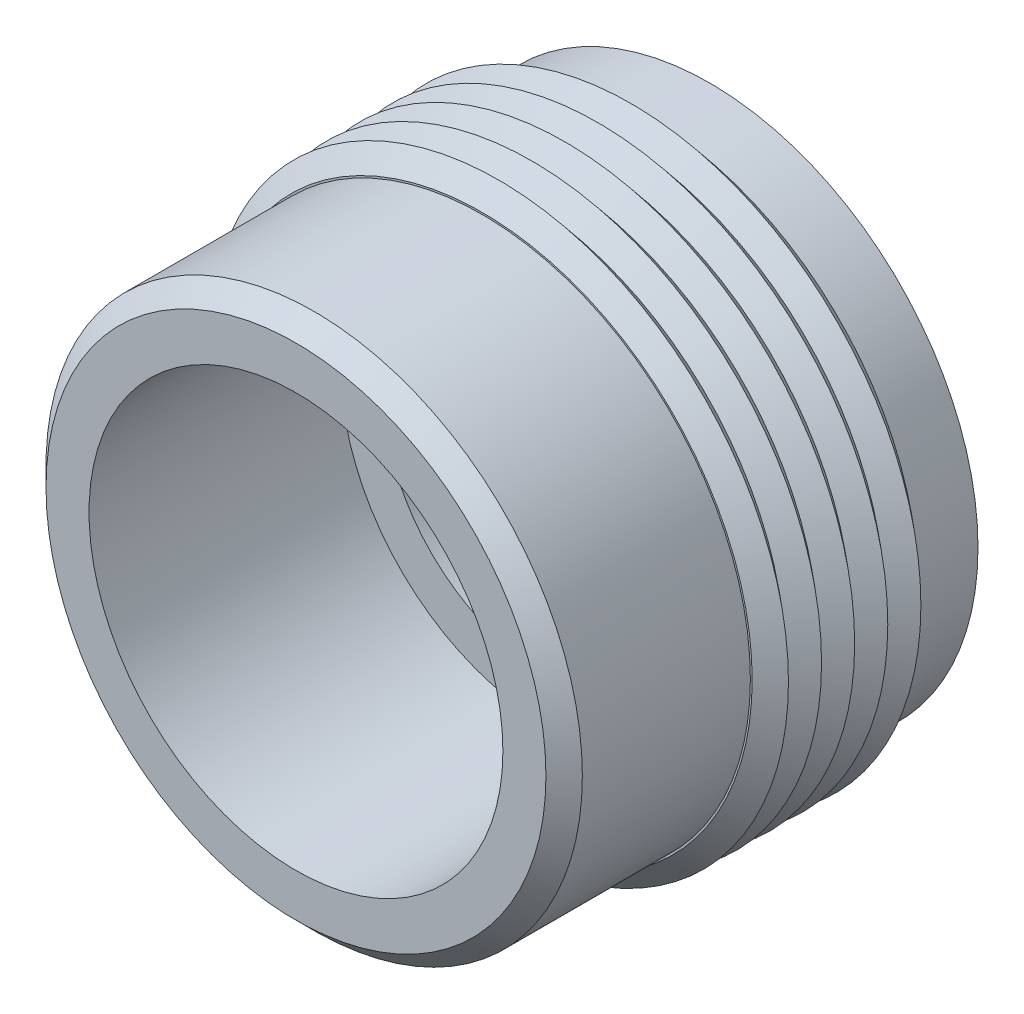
SolidWorks part; units mm, degrees
ref_plane "Front" through (0, 0, 0) normal (0, 0, 1) x (1, 0, 0)
ref_plane "Top" through (0, 0, 0) normal (0, 1, 0) x (1, 0, 0)
ref_plane "Right" through (0, 0, 0) normal (1, 0, 0) x (0, 0, -1)
sketch "Sketch1" plane through (0, 0, 0) normal (1, 0, 0) x (0, 0, -1)
  line L0 (-2.3812, 10.287) -> (0, 10.287)
  line L1 (-2.3812, 11.1125) -> (-8.7313, 11.1125)
  line L2 (-8.7313, 11.1125) -> (-8.7313, 10.287)
  line L3 (-8.7313, 10.287) -> (-15.875, 10.287)
  line L4 (-15.875, 10.287) -> (-15.875, 0)
  line L5 (-15.875, 7.9375) -> (-6.223, 7.9375) construction
  line L6 (0, 10.287) -> (0, 0)
  line L7 (0, 0) -> (-15.875, 0)
  line L9 (-2.3812, 10.287) -> (-2.3812, 11.1125)
  line L11 (0, 0) -> (43.4699, 0) construction
  line L12 (-6.223, 4.7625) -> (-6.223, 7.9375) construction
  dimension "D1" = 7.9375
  dimension "D2" = 6.35
  dimension "D3" = 20.574
  dimension "D4" = 22.225
  dimension "D5" = 2.3812
  dimension "D6" = 9.652
  dimension "D9" = 7.1438
revolve "Revolve2" add sketch "Sketch1" angle 360 about L11
sketch "Sketch4" plane through (0, 0, 0) normal (1, 0, 0) x (0, 0, -1)
  line L0 (-15.875, 10.287) -> (-15.875, -10.287) construction
  line L1 (-15.875, 7.9375) -> (-6.223, 7.9375)
  line L2 (-15.875, 7.9375) -> (-15.875, 0)
  line L3 (-15.875, 0) -> (-6.223, 0)
  line L4 (-6.223, 7.9375) -> (-6.223, 0)
  line L5 (-8.7313, 0) -> (-15.875, 0) construction
  line L6 (-2.3812, 0) -> (-8.7313, 0) construction
  line L7 (0, 0) -> (7.1271, 0) construction
  dimension "D1" = 9.652
  dimension "D2" = 15.875
revolve "Cut-Revolve4" cut sketch "Sketch4" angle 360 about L7
sketch "Sketch5" plane through (0, 0, 6.223) normal (0, 0, 1) x (1, 0, 0)
  circle A0 centre (0, 0) radius 6.2992
  dimension "D1" = 12.5984
extrude "Extrude1" cut sketch "Sketch5" against normal through all
sketch "Sketch6" plane through (0, 0, 0) normal (0, 1, 0) x (1, 0, 0)
  line L0 (10.3568, -8.7313) -> (11.1125, -8.0963)
  line L1 (-11.1125, -8.7313) -> (11.1125, -8.7313) construction
  line L2 (11.1125, -8.7313) -> (11.1125, -2.3812) construction
  line L3 (11.1125, -8.0963) -> (10.3568, -7.4613)
  line L4 (0, 0) -> (0, 4.0294) construction
  line L5 (0, -2.3812) -> (0, -8.7313) construction
  line L6 (10.3568, -8.7313) -> (10.9136, -8.8782)
  line L7 (10.9136, -8.8782) -> (11.9577, -8.8782)
  line L8 (11.9577, -8.8782) -> (11.9577, 4.4201)
  line L9 (10.3568, -7.4613) -> (11.1125, -6.8263)
  line L10 (11.1125, -6.8263) -> (10.3568, -6.1913)
  line L11 (10.3568, -6.1913) -> (11.1125, -5.5563)
  line L12 (11.1125, -5.5563) -> (10.3568, -4.9213)
  line L13 (10.3568, -4.9213) -> (11.1125, -4.2863)
  line L14 (11.1125, -4.2863) -> (10.3568, -3.6513)
  line L15 (10.3568, -3.6513) -> (11.1125, -3.0163)
  line L16 (11.1125, -3.0163) -> (10.3568, -2.3813)
  line L17 (10.3568, -2.3813) -> (10.3568, 4.4201)
  line L18 (10.3568, 4.4201) -> (11.9577, 4.4201)
  dimension "D1" = 20.7137
  dimension "D2" = 0.635
  dimension "D3" = 1.27
  dimension "D4" = 22.225
revolve "7/8-20 UNEF-2A" cut sketch "Sketch6" angle 360 about L4
sketch "Sketch7" plane through (0, 0, 0) normal (1, 0, 0) x (0, 0, -1)
  line L0 (0, 0) -> (7.421, 0) construction
  line L1 (-15.875, 9.5885) -> (-15.1765, 10.287)
  line L2 (-15.875, 10.287) -> (-15.875, -10.287) construction
  line L3 (-8.7313, 10.287) -> (-15.875, 10.287) construction
  line L4 (-6.223, 7.9375) -> (-15.875, 7.9375) construction
  line L5 (-15.1765, 10.287) -> (-15.875, 10.287)
  line L6 (-15.875, 10.287) -> (-15.875, 9.5885)
  dimension "D1" = 1.651
  dimension "D2" = 45
revolve "Cut-Revolve5" cut sketch "Sketch7" angle 360 about L0
equation "\"Buoyancy\"=\"SW-Volume\"*(\"SW-Density\"-.037062)"
